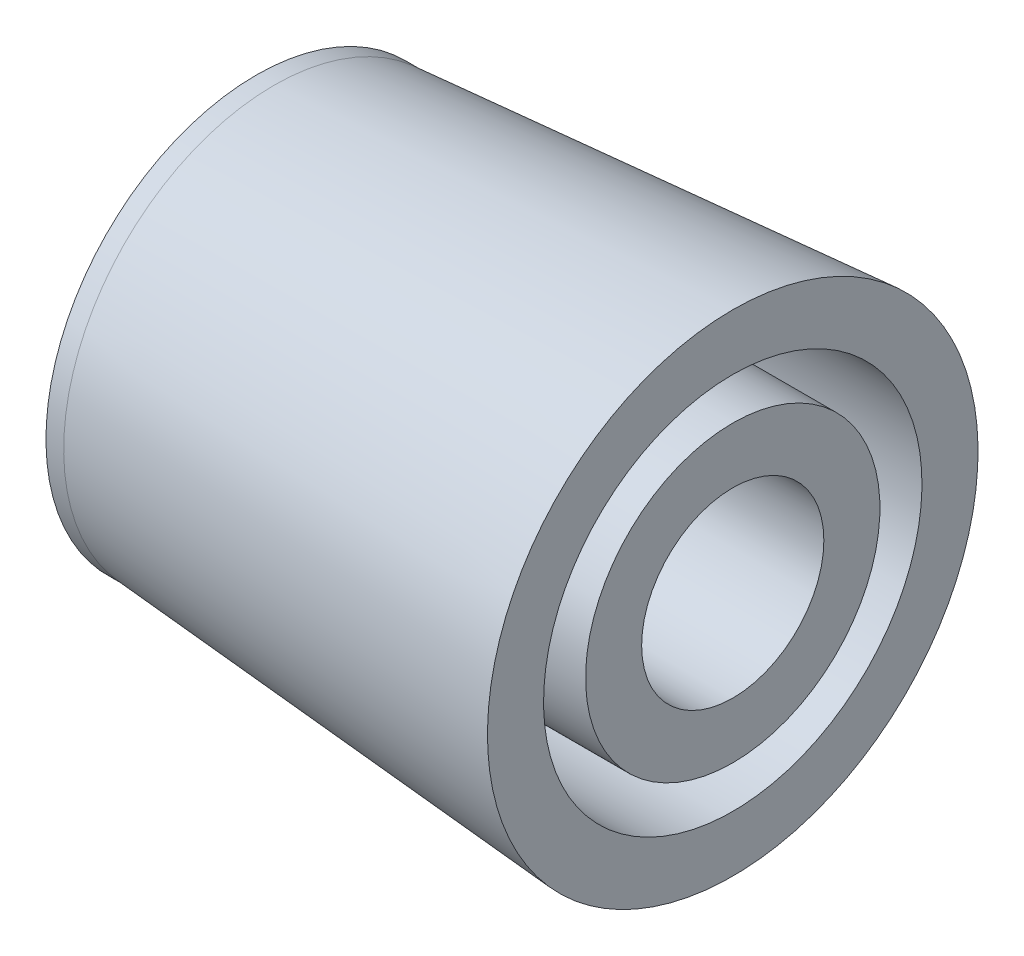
SolidWorks part; units mm, degrees
ref_plane "Přední rovina" through (0, 0, 0) normal (0, 0, 1) x (1, 0, 0)
ref_plane "Horní rovina" through (0, 0, 0) normal (0, 1, 0) x (1, 0, 0)
ref_plane "Pravá rovina" through (0, 0, 0) normal (1, 0, 0) x (0, 0, -1)
sketch "Skica1" plane through (0, 0, 0) normal (0, 0, 1) x (1, 0, 0)
  line L0 (24.6137, -1.6228) -> (24.6137, 5.8772)
  line L1 (24.6137, 5.8772) -> (25.2463, 5.8772)
  line L2 (25.2463, 5.8772) -> (41.6137, 7.1272)
  line L3 (41.6137, 7.1272) -> (41.6137, 5.1272)
  line L4 (41.6137, 5.1272) -> (31.6137, 5.1272)
  line L5 (31.6137, 5.1272) -> (31.6137, 3.6272)
  line L6 (31.6137, 3.6272) -> (41.6137, 3.6272)
  line L7 (41.6137, 3.6272) -> (41.6137, 1.6272)
  line L8 (41.6137, 1.6272) -> (26.6137, 1.6272)
  line L9 (26.6137, 1.6272) -> (26.6137, -1.6228)
  line L10 (26.6137, -1.6228) -> (24.6137, -1.6228)
  dimension "D1" = 17
  dimension "D2" = 15
  dimension "D3" = 10
  dimension "D4" = 7.5
  dimension "D5" = 3.25
  dimension "D6" = 1.5
  dimension "D7" = 8.75
  dimension "D8" = 2
revolve "Rotovat1" add sketch "Skica1" angle 360 about L10
equation "\"¨17\"=77.3006"
